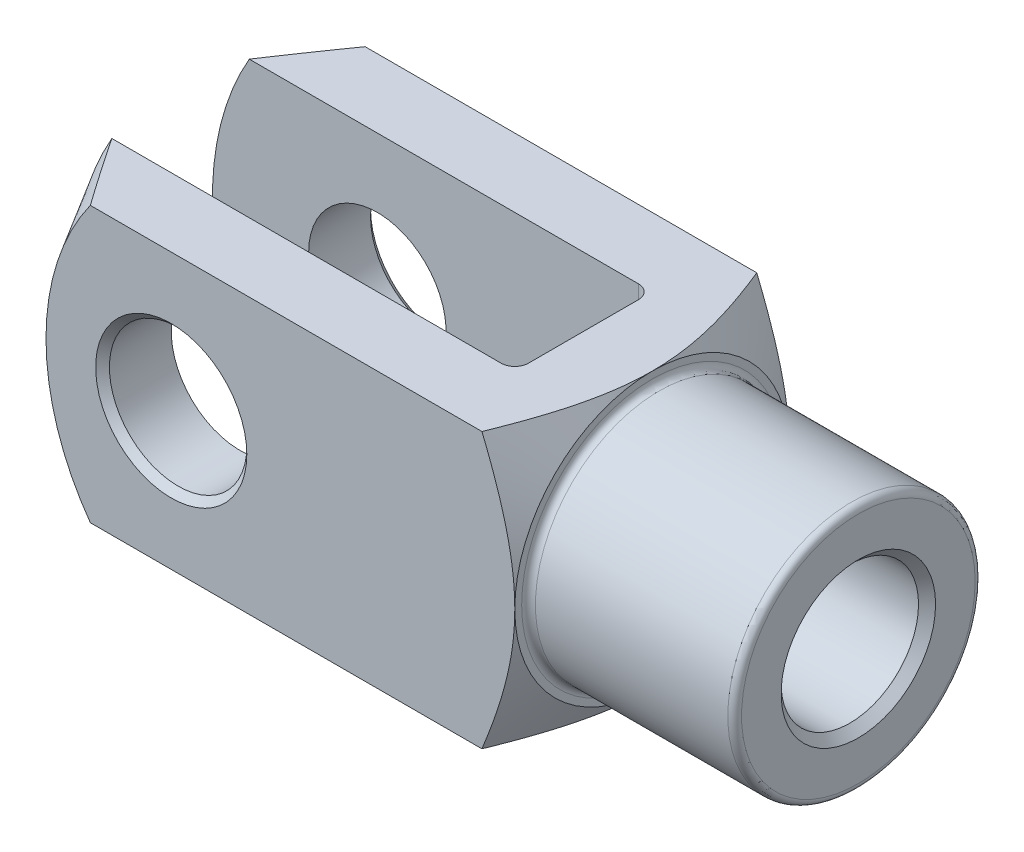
SolidWorks part; units mm, degrees
ref_plane "Front Plane" through (0, 0, 0) normal (0, 0, 1) x (1, 0, 0)
ref_plane "Top Plane" through (0, 0, 0) normal (0, 1, 0) x (1, 0, 0)
ref_plane "Right Plane" through (0, 0, 0) normal (1, 0, 0) x (0, 0, -1)
sketch "Sketch1" plane through (0, 0, 0) normal (1, 0, 0) x (0, 0, -1)
  line L0 (0, 0) -> (0, 50000) construction
  line L1 (0, 0) -> (50000, 0) construction
  line L2 (-10, -10) -> (-10, 10)
  line L3 (-10, 10) -> (10, 10)
  line L4 (10, -10) -> (10, 10)
  line L5 (-10, -10) -> (10, -10)
  point P9 (0, 10)
  point P11 (10, 0)
  point P12 (-10, 0)
  dimension "D1" = 20
  dimension "D2" = 20
extrude "Extrude1" add sketch "Sketch1" against normal blind 52
sketch "Sketch2" plane through (0, 0, 0) normal (1, 0, 0) x (0, 0, -1)
  circle A0 centre (0, 0) radius 9
  circle A1 centre (0, 0) radius 18
  dimension "D1" = 18
  dimension "D2" = 36
extrude "Extrude2" cut sketch "Sketch2" against normal blind 15
sketch "Sketch3" plane through (0, 0, 10) normal (0, 0, 1) x (1, 0, 0)
  circle A0 centre (-40, 0) radius 5
  dimension "D1" = 10
  dimension "D2" = 40
extrude "Extrude3" cut sketch "Sketch3" against normal through all
sketch "Sketch4" plane through (0, 10, 0) normal (0, 1, 0) x (1, 0, 0)
  line L0 (0, 0) -> (-50000, 0) construction
  line L1 (-52, -5) -> (-52, 5)
  line L2 (-52, 10) -> (-52, -10) construction
  line L3 (-52, 5) -> (-20, 5)
  line L4 (-20, 5) -> (-20, -5)
  line L5 (-40, 10) -> (-40, -10) construction
  line L6 (-52, -5) -> (-20, -5)
  point P7 (-40, 0)
  point P13 (-20, 0)
  point P14 (-52, 0)
  dimension "D1" = 20
  dimension "D2" = 10
extrude "Extrude4" cut sketch "Sketch4" against normal through all
fillet "Fillet1" radius 1 2 edges at (-20, 0, 5) (-20, 0, -5)
fillet "Fillet2" radius 0.5 2 edges at (0, 0, -9) (-15, 0, -9)
chamfer "Chamfer2" distance 0.5 angle 45 2 edges at (-35, 0, -10) (-35, 0, 10)
sketch "Sketch6" plane through (0, 0, 0) normal (0, 0, 1) x (1, 0, 0)
  line L0 (-15, -10) -> (-15, -20)
  line L1 (-15, -20) -> (-20.7735, -20)
  line L2 (-20.7735, -20) -> (-15, -10)
  dimension "D1" = 30
  dimension "D2" = 20
revolve "Cut-Revolve1" cut sketch "Sketch6" angle 360 about axis through (-15, 0, 0) along (1, 0, 0)
sketch "Sketch7" plane through (0, 0, 0) normal (0, 1, 0) x (1, 0, 0)
  line L0 (-49.1132, -10) -> (-52, -5)
  line L1 (-52, 5) -> (-49.1132, 10)
  line L2 (-49.1132, 10) -> (-72, 10)
  line L3 (-52, 5) -> (-52, -5)
  line L4 (-72, 10) -> (-72, -10)
  line L5 (-72, -10) -> (-49.1132, -10)
  line L6 (-52, 10) -> (-17.3915, 10) construction
  line L7 (-52, -10) -> (-17.3915, -10) construction
  line L8 (-32, 0.6162) -> (-32, 50000.6162) construction
  dimension "D1" = 120
  dimension "D2" = 20
  dimension "D3" = 20
revolve "Cut-Revolve2" cut sketch "Sketch7" angle 180 about L8
sketch "Sketch8" plane through (0, 0, 0) normal (1, 0, 0) x (0, 0, -1)
  circle A0 centre (0, 0) radius 5
  dimension "D1" = 10
extrude "Extrude5" cut sketch "Sketch8" against normal through all
chamfer "Chamfer3" distance 0.62 angle 45 1 edges at (0, 0, -5)
equation "\"D2@Sketch1\" = \"D1@Sketch1\""
equation "\"D2@Sketch2\" = \"D1@Sketch2\"*2"
equation "\"D2@Sketch6\" = \"D1@Sketch1\""
equation "\"D2@Sketch7\" = \"D1@Sketch1\""
equation "\"D3@Sketch7\" = \"D1@Sketch1\""
